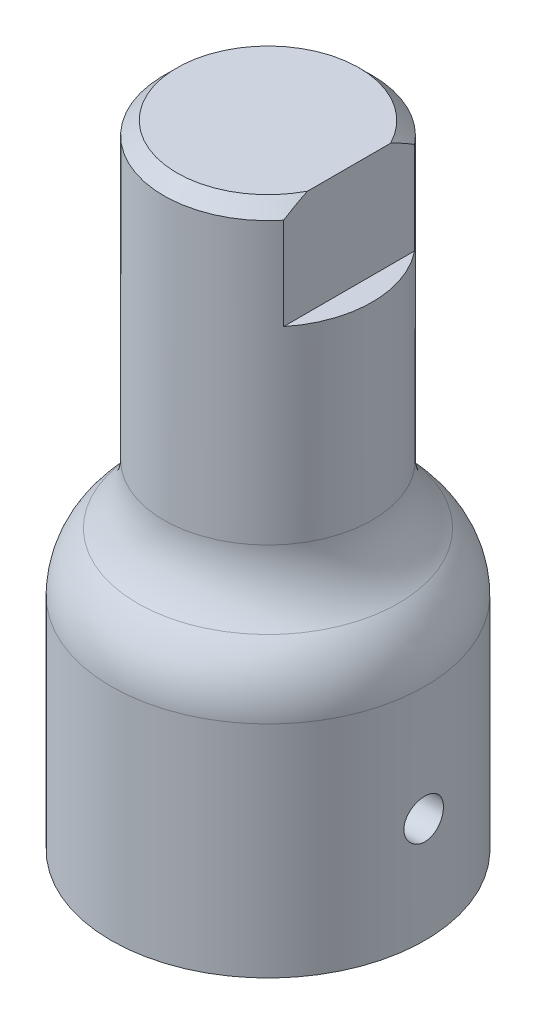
SolidWorks part; units mm, degrees
ref_plane "Front" through (0, 0, 0) normal (0, 0, 1) x (1, 0, 0)
ref_plane "Top" through (0, 0, 0) normal (0, 1, 0) x (-1, 0, 0)
ref_plane "Right" through (0, 0, 0) normal (1, 0, 0) x (0, 0, -1)
sketch "Sketch1" plane through (0, 0, 0) normal (0, 1, 0) x (-1, 0, 0)
  circle A0 centre (0, 0) radius 6.2865
  dimension "D1" = 12.573
extrude "Base-Extrude" add sketch "Sketch1" along normal blind 38.1
sketch "Sketch3" plane through (0, 0, 0) normal (0, 1, 0) x (-1, 0, 0)
  circle A1 centre (0, 0) radius 9.4615
  circle A2 centre (0, 0) radius 9.4615
  dimension "D1" = 3.175
extrude "Boss-Extrude1" add sketch "Sketch3" along normal blind 15.875
sketch "Sketch4" plane through (0, 0, 0) normal (0, 1, 0) x (-1, 0, 0)
  line L0 (-4.8895, 4.2479) -> (-4.8895, -4.2479)
  arc A1 (-4.8895, -4.2479) -> (-4.8895, 4.2479) centre (0, 0) ccw
  dimension "D2" = 6.477
  dimension "D3" = 6.477
  dimension "D1" = 1.5875
extrude "Cut-Extrude1" cut sketch "Sketch4" along normal blind 12.7
fillet "Fillet1" radius 4.7625 1 edges at (0, 15.875, 6.2865)
fillet "Fillet2" radius 4.7625 1 edges at (0, 15.875, 9.4615)
sketch "Sketch5" plane through (4.8895, 0, 0) normal (-1, 0, 0) x (0, 0, 1)
  line L0 (4.2479, 0) -> (-4.2479, 0) construction
  circle A0 centre (0, 6.35) radius 1.1906
  dimension "D2" = 2.3813
  dimension "D1" = 6.35
extrude "Cut-Extrude2" cut sketch "Sketch5" against normal through all
sketch "Sketch7" plane through (0, 38.1, 0) normal (0, 1, 0) x (-1, 0, 0)
  line L0 (-4.8895, 4.2479) -> (-4.8895, -4.2479) construction
  line L1 (-4.8895, 3.9513) -> (-4.8895, -3.9513)
  circle A1 centre (0, 0) radius 6.2865 construction
  arc A2 (-4.8895, 3.9513) -> (-4.8895, -3.9513) centre (0, 0) ccw
extrude "Cut-Extrude3" cut sketch "Sketch7" against normal blind 6.35
chamfer "Chamfer1" distance 0.7937 angle 45 1 edges at (-6.2865, 38.1, 0)
